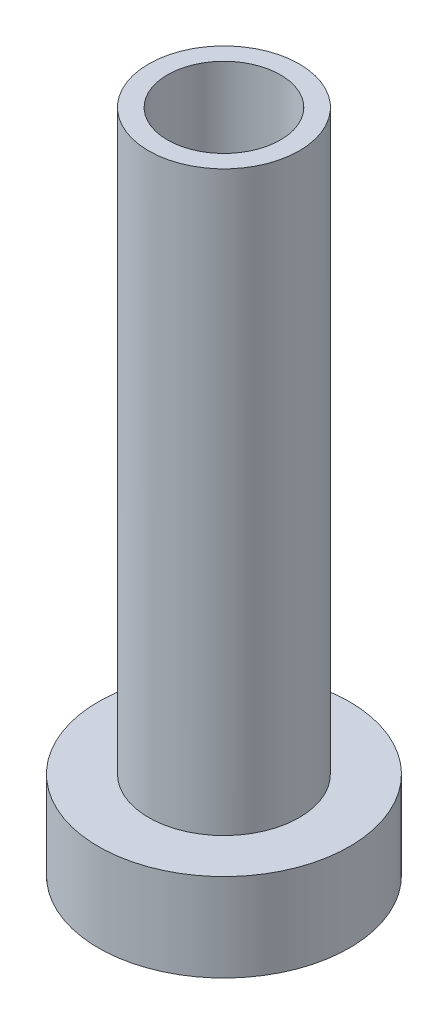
SolidWorks part; units mm, degrees
ref_plane "Plan de face" through (0, 0, 0) normal (0, 0, 1) x (1, 0, 0)
ref_plane "Plan de dessus" through (0, 0, 0) normal (0, 1, 0) x (1, 0, 0)
ref_plane "Plan de droite" through (0, 0, 0) normal (1, 0, 0) x (0, 0, -1)
sketch "Esquisse1" plane through (0, 0, 0) normal (0, 0, 1) x (1, 0, 0)
  line L0 (0, 0) -> (0, 67.7263) construction
  line L1 (-4, 0) -> (-10, 0)
  line L2 (55, 0) -> (-55, 0) construction
  line L3 (-10, 0) -> (-10, 7)
  line L4 (-10, 7) -> (-6, 7)
  line L5 (-6, 7) -> (-6, 75)
  line L6 (-6, 75) -> (-4, 75)
  line L7 (-4, 75) -> (-4, 0)
  dimension "D1" = 20
  dimension "D2" = 12
  dimension "D3" = 7
  dimension "D4" = 8
  dimension "D5" = 75
revolve "Révolution1" add sketch "Esquisse1" angle 360 about L0
sketch "Esquisse2" plane through (0, 0, 0) normal (0, 1, 0) x (1, 0, 0)
  circle A0 centre (0, 0) radius 4.75
  dimension "D1" = 9.5
extrude "Enlèv. mat.-Extru.1" cut sketch "Esquisse2" along normal blind 40
chamfer "Chanfrein1" distance 1 angle 45 1 edges at (0, 0, 4.75)
sketch "Esquisse3" plane through (0, 75, 0) normal (0, 1, 0) x (1, 0, 0)
  circle A0 centre (0, 0) radius 6 construction
  circle A1 centre (0, 0) radius 6
extrude "Enlèv. mat.-Extru.2" cut sketch "Esquisse3" against normal blind 22
sketch "Esquisse4" plane through (0, 53, 0) normal (0, 1, 0) x (1, 0, 0)
  circle A0 centre (0, 0) radius 4.5
  circle A1 centre (0, 0) radius 4.5 construction
extrude "Enlèv. mat.-Extru.3" cut sketch "Esquisse4" against normal blind 30
